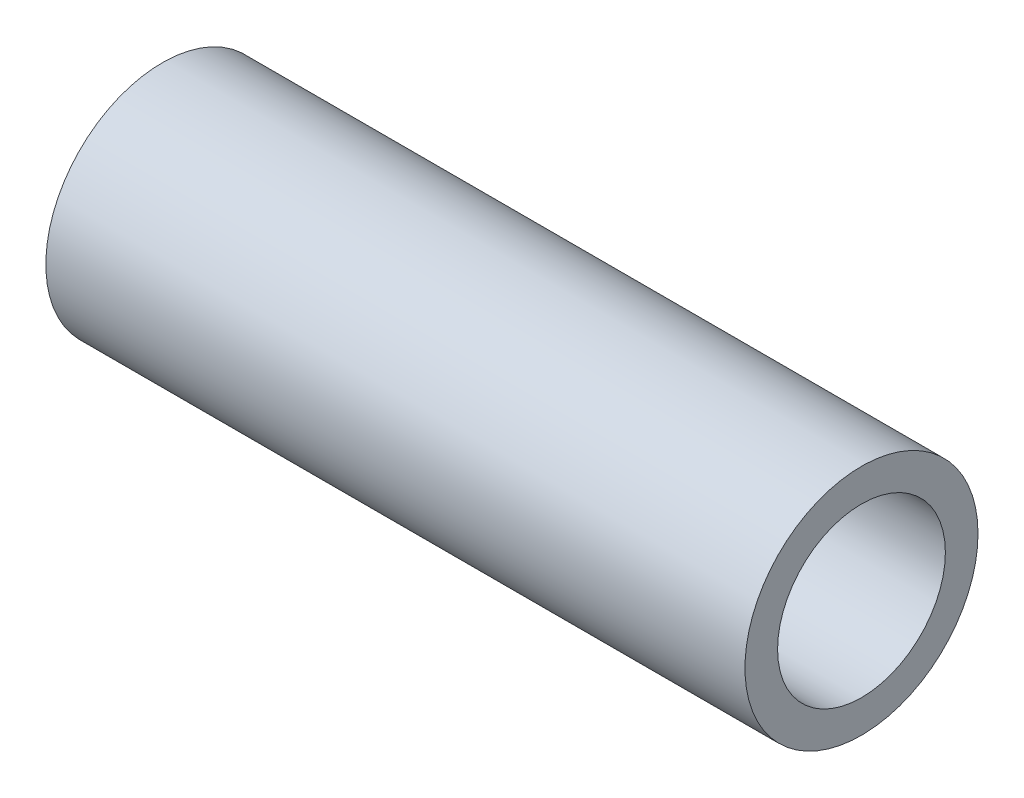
SolidWorks part; units mm, degrees
ref_plane "Front" through (0, 0, 0) normal (0, 0, 1) x (1, 0, 0)
ref_plane "Top" through (0, 0, 0) normal (0, 1, 0) x (1, 0, 0)
ref_plane "Right" through (0, 0, 0) normal (1, 0, 0) x (0, 0, -1)
other "Configuration Table"
sketch "Sketch1" plane through (0, 0, 0) normal (1, 0, 0) x (0, 0, -1)
  circle A0 centre (0, 0) radius 5
  dimension "d" = 10
extrude "Base-Extrude" add sketch "Sketch1" along normal blind 30
sketch "Sketch2" plane through (0, 0, 0) normal (0, 0, 1) x (1, 0, 0)
  line L0 (15, 7.0065) -> (15, -7.6583) construction
  line L2 (-23.677, 0) -> (34.1961, 0) construction
  line L3 (30, 0) -> (30, 3.6)
  line L4 (30, -5) -> (30, 5) construction
  line L5 (30, 3.6) -> (23.35, 3.6)
  line L6 (23.35, 3.6) -> (20.7344, 0)
  line L7 (20.7344, 0) -> (30, 0)
  line L8 (9.2656, 0) -> (0, 0)
  line L9 (6.65, 3.6) -> (9.2656, 0)
  line L10 (0, 3.6) -> (6.65, 3.6)
  line L11 (0, 0) -> (0, 3.6)
  line L12 (0, 5) -> (0, -5) construction
  dimension "dt" = 7.2
  dimension "t" = 6.65
  dimension "D3" = 54
revolve "Cut-Revolve1" cut sketch "Sketch2" angle 360 about L2
